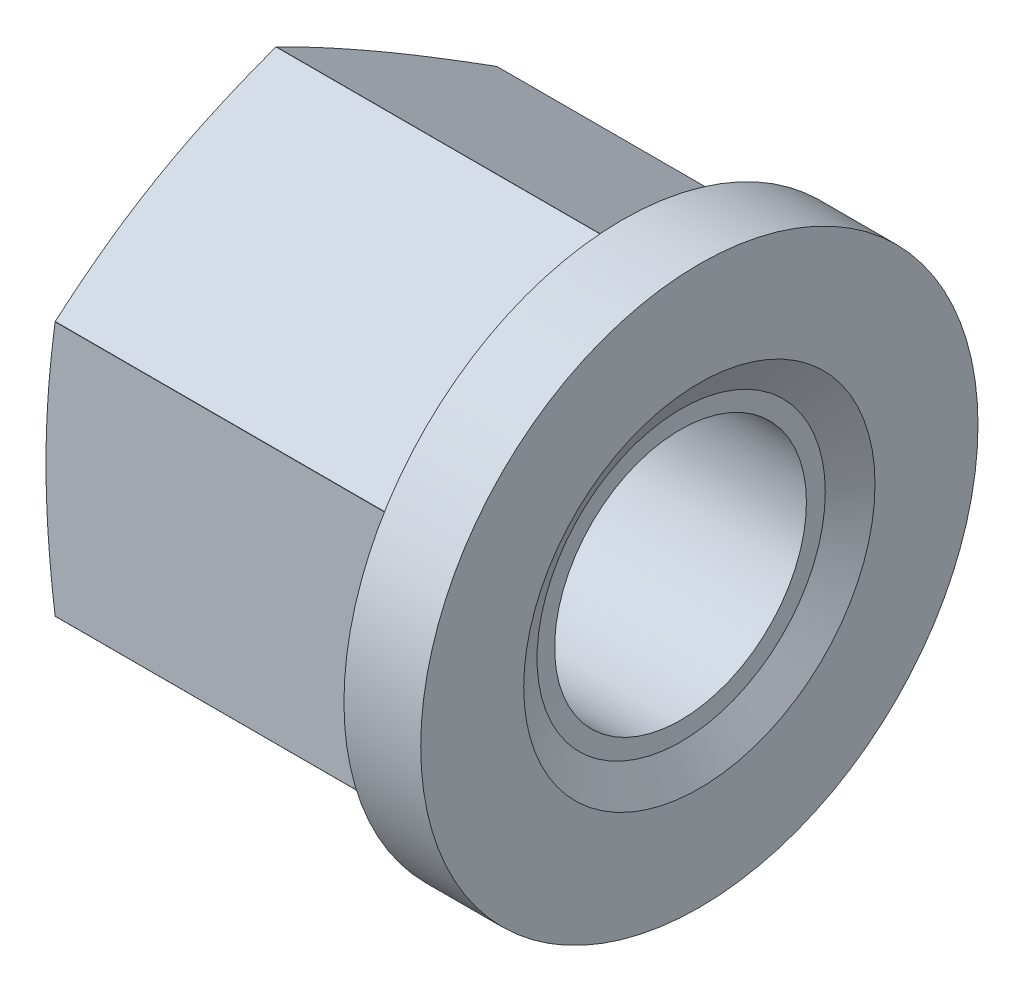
SolidWorks part; units mm, degrees
ref_plane "Plan de face" through (0, 0, 0) normal (0, 0, 1) x (1, 0, 0)
ref_plane "Plan de dessus" through (0, 0, 0) normal (0, 1, 0) x (1, 0, 0)
ref_plane "Plan de droite" through (0, 0, 0) normal (1, 0, 0) x (0, 0, -1)
ref_plane "Plan4" through (-45, 0, 0) normal (1, 0, 0) x (0, 0, -1)
sketch "Esquisse1" plane through (0, 0, 0) normal (0, 0, 1) x (1, 0, 0)
  line L0 (-45, 18.2814) -> (-43.1055, 15)
  line L1 (-43.1055, 15) -> (-43.0393, 13.1055)
  line L2 (-43.0393, 13.1055) -> (-1.9607, 13.1055)
  line L3 (-1.9607, 13.1055) -> (-1.8945, 15)
  line L4 (-1.8945, 15) -> (0, 18.2814)
  line L5 (0, 18.2814) -> (0, 29)
  line L6 (0, 29) -> (-8, 29)
  line L7 (-8, 29) -> (-8, 26.55)
  line L8 (-8, 26.55) -> (-44.0488, 26.55)
  line L9 (-44.0488, 26.55) -> (-45, 23)
  line L10 (-45, 23) -> (-45, 18.2814)
  line L11 (0, 0) -> (-45, 0) construction
revolve "Révolution1" add sketch "Esquisse1" angle 360 about L11
sketch "Esquisse2" plane through (-45, 0, 0) normal (1, 0, 0) x (0, 0, -1)
  line L0 (-46, 46) -> (-46, -46)
  line L1 (-46, -46) -> (46, -46)
  line L2 (46, -46) -> (46, 46)
  line L3 (46, 46) -> (-46, 46)
  line L4 (-23, 13.2791) -> (-23, -13.2791)
  line L5 (-23, -13.2791) -> (0, -26.5581)
  line L6 (0, -26.5581) -> (23, -13.2791)
  line L7 (23, -13.2791) -> (23, 13.2791)
  line L8 (23, 13.2791) -> (0, 26.5581)
  line L9 (0, 26.5581) -> (-23, 13.2791)
extrude "Enlèv. mat.-Extru.1" cut sketch "Esquisse2" along normal blind 37.01
